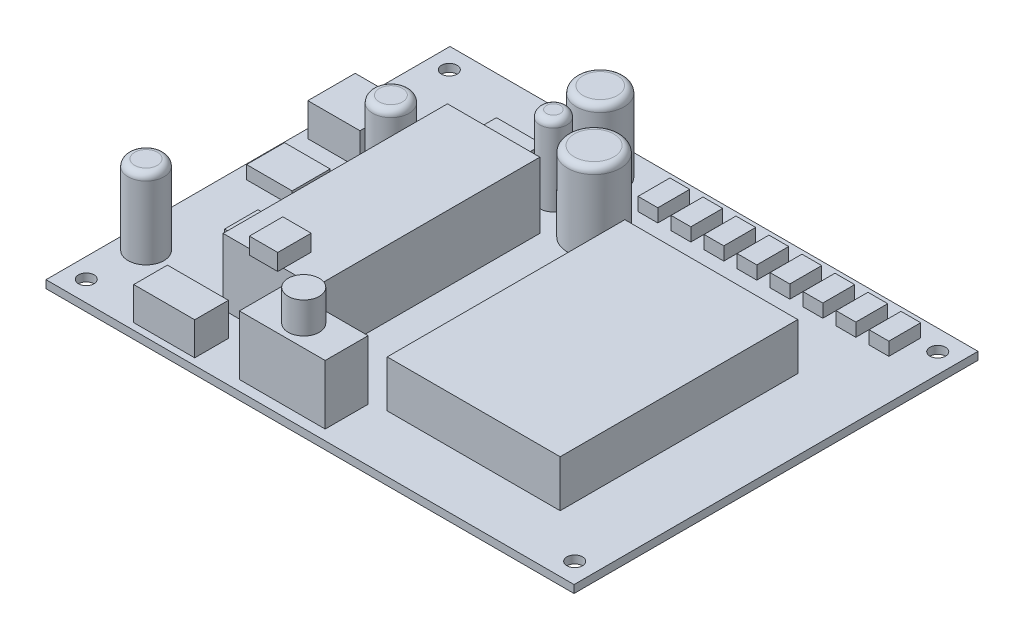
SolidWorks part; units mm, degrees
ref_plane "Front Plane" through (0, 0, 0) normal (0, 0, 1) x (1, 0, 0)
ref_plane "Top Plane" through (0, 0, 0) normal (0, 1, 0) x (1, 0, 0)
ref_plane "Right Plane" through (0, 0, 0) normal (1, 0, 0) x (0, 0, -1)
sketch "Sketch1" plane through (0, 0, 0) normal (0, 1, 0) x (1, 0, 0)
  line L1 (-50.8, -38.862) -> (50.8, -38.862)
  line L2 (-50.8, -38.862) -> (-50.8, 38.862)
  line L3 (-50.8, 38.862) -> (50.8, 38.862)
  line L4 (50.8, -38.862) -> (50.8, 38.862)
  line L5 (0, 38.862) -> (0, -38.862) construction
  line L6 (-50.8, 0) -> (50.8, 0) construction
  line L7 (-46.99, -34.925) -> (46.99, -34.925) construction
  line L8 (-46.99, -34.925) -> (-46.99, 34.925) construction
  line L9 (-46.99, 34.925) -> (46.99, 34.925) construction
  line L10 (46.99, -34.925) -> (46.99, 34.925) construction
  line L11 (0, 34.925) -> (0, -34.925) construction
  line L12 (-46.99, 0) -> (46.99, 0) construction
  circle A0 centre (-46.99, 34.925) radius 1.5
  circle A1 centre (46.99, 34.925) radius 1.5
  circle A2 centre (46.99, -34.925) radius 1.5
  circle A3 centre (-46.99, -34.925) radius 1.5
  point P0 (0, 0)
  point P4 (0, 0)
  dimension "D5" = 3
  dimension "D1" = 101.6
  dimension "D2" = 77.724
  dimension "D3" = 69.85
  dimension "D4" = 93.98
extrude "Boss-Extrude1" add sketch "Sketch1" along normal blind 1.5
sketch "Sketch2" plane through (0, 1.5, 0) normal (0, 1, 0) x (1, 0, 0)
  line L1 (-28.7841, -26.8116) -> (-11.0041, -26.8116)
  line L2 (-28.7841, -26.8116) -> (-28.7841, 16.3684)
  line L3 (-28.7841, 16.3684) -> (-11.0041, 16.3684)
  line L4 (-11.0041, -26.8116) -> (-11.0041, 16.3684)
  line L5 (-19.8941, 16.3684) -> (-19.8941, -26.8116) construction
  line L6 (-28.7841, -5.2216) -> (-11.0041, -5.2216) construction
  point P0 (-19.8941, -5.2216)
  dimension "D1" = 17.78
  dimension "D2" = 43.18
extrude "Boss-Extrude2" add sketch "Sketch2" along normal blind 12.7
sketch "Sketch3" plane through (0, 1.5, 0) normal (0, 1, 0) x (1, 0, 0)
  line L1 (-15.5609, -36.8933) -> (0.9491, -36.8933)
  line L2 (-15.5609, -36.8933) -> (-15.5609, -28.6383)
  line L3 (-15.5609, -28.6383) -> (0.9491, -28.6383)
  line L4 (0.9491, -36.8933) -> (0.9491, -28.6383)
  line L5 (-7.3059, -28.6383) -> (-7.3059, -36.8933) construction
  line L6 (-15.5609, -32.7658) -> (0.9491, -32.7658) construction
  point P0 (-7.3059, -32.7658)
  dimension "D1" = 16.51
  dimension "D2" = 8.255
extrude "Boss-Extrude3" add sketch "Sketch3" along normal blind 11.43
sketch "Sketch4" plane through (0, 12.93, 0) normal (0, 1, 0) x (1, 0, 0)
  line L0 (0.9491, -36.8933) -> (0.9491, -28.6383) construction
  line L1 (0.9491, -28.6383) -> (-15.5609, -28.6383) construction
  circle A0 centre (-7.3059, -32.7658) radius 3
  point P2 (0.9491, -32.7658)
  point P3 (-7.3059, -28.6383)
  dimension "D1" = 6
extrude "Boss-Extrude4" add sketch "Sketch4" along normal blind 6
sketch "Sketch5" plane through (0, 1.5, 0) normal (0, 1, 0) x (1, 0, 0)
  line L1 (3.8917, -27.9009) -> (37.1657, -27.9009)
  line L2 (3.8917, -27.9009) -> (3.8917, 17.8191)
  line L3 (3.8917, 17.8191) -> (37.1657, 17.8191)
  line L4 (37.1657, -27.9009) -> (37.1657, 17.8191)
  line L5 (20.5287, 17.8191) -> (20.5287, -27.9009) construction
  line L6 (3.8917, -5.0409) -> (37.1657, -5.0409) construction
  point P0 (20.5287, -5.0409)
  dimension "D1" = 33.274
  dimension "D2" = 45.72
extrude "Boss-Extrude5" add sketch "Sketch5" along normal blind 9
sketch "Sketch6" plane through (0, 1.5, 0) normal (0, 1, 0) x (1, 0, 0)
  circle A0 centre (-14.5848, 31.5625) radius 4.5706
  circle A1 centre (-15.1058, 23.0764) radius 2.6054
  circle A2 centre (-5.2053, 20.992) radius 5.0799
  circle A3 centre (-33.1203, 9.8261) radius 3.5042
  circle A4 centre (-46.0728, -24.3418) radius 3.4532
extrude "Boss-Extrude6" add sketch "Sketch6" along normal blind 15.24
fillet "Fillet1" radius 1.27 5 edges at (-46.0728, 16.74, 27.7951) (-33.1203, 16.74, -6.3218) (-14.5848, 16.74, -26.9919) (-15.1058, 16.74, -20.471) (-5.2053, 16.74, -15.9121)
sketch "Sketch7" plane through (0, 1.5, 0) normal (0, 1, 0) x (1, 0, 0)
  line L0 (1.163, 35.5783) -> (4.9619, 35.5783)
  line L1 (-48.1439, 4.3834) -> (-39.3772, 4.3834)
  line L2 (-48.1439, 4.3834) -> (-48.1439, -2.9222)
  line L3 (-48.1439, -2.9222) -> (-39.3772, -2.9222)
  line L4 (-39.3772, 4.3834) -> (-39.3772, -2.9222)
  line L5 (-43.7606, -2.9222) -> (-43.7606, 4.3834) construction
  line L6 (-48.1439, 0.7306) -> (-39.3772, 0.7306) construction
  line L7 (-39.5233, -9.3512) -> (-32.3638, -9.3512)
  line L8 (-39.5233, -9.3512) -> (-39.5233, -15.7801)
  line L9 (-39.5233, -15.7801) -> (-32.3638, -15.7801)
  line L10 (-32.3638, -9.3512) -> (-32.3638, -15.7801)
  line L11 (-35.9436, -15.7801) -> (-35.9436, -9.3512) construction
  line L12 (-39.5233, -12.5656) -> (-32.3638, -12.5656) construction
  line L13 (-31.9255, 28.9302) -> (-23.0126, 28.9302)
  line L14 (-31.9255, 28.9302) -> (-31.9255, 24.5468)
  line L15 (-31.9255, 24.5468) -> (-23.0126, 24.5468)
  line L16 (-23.0126, 28.9302) -> (-23.0126, 24.5468)
  line L17 (-27.4691, 24.5468) -> (-27.4691, 28.9302) construction
  line L18 (-31.9255, 26.7385) -> (-23.0126, 26.7385) construction
  line L19 (-5.187, 35.5783) -> (-1.3881, 35.5783)
  line L20 (-5.187, 35.5783) -> (-5.187, 29.4416)
  line L21 (-5.187, 29.4416) -> (-1.3881, 29.4416)
  line L22 (-1.3881, 35.5783) -> (-1.3881, 29.4416)
  line L23 (-3.2875, 29.4416) -> (-3.2875, 35.5783) construction
  line L24 (-5.187, 32.5099) -> (-1.3881, 32.5099) construction
  line L25 (1.163, 35.5783) -> (1.163, 29.4416)
  line L26 (1.163, 29.4416) -> (4.9619, 29.4416)
  line L27 (4.9619, 35.5783) -> (4.9619, 29.4416)
  line L28 (3.0625, 29.4416) -> (3.0625, 35.5783) construction
  line L29 (1.163, 32.5099) -> (4.9619, 32.5099) construction
  line L30 (7.513, 35.5783) -> (11.3119, 35.5783)
  line L31 (7.513, 35.5783) -> (7.513, 29.4416)
  line L32 (7.513, 29.4416) -> (11.3119, 29.4416)
  line L33 (11.3119, 35.5783) -> (11.3119, 29.4416)
  line L34 (9.4125, 29.4416) -> (9.4125, 35.5783) construction
  line L35 (7.513, 32.5099) -> (11.3119, 32.5099) construction
  line L36 (13.863, 35.5783) -> (17.6619, 35.5783)
  line L37 (13.863, 35.5783) -> (13.863, 29.4416)
  line L38 (13.863, 29.4416) -> (17.6619, 29.4416)
  line L39 (17.6619, 35.5783) -> (17.6619, 29.4416)
  line L40 (15.7625, 29.4416) -> (15.7625, 35.5783) construction
  line L41 (13.863, 32.5099) -> (17.6619, 32.5099) construction
  line L42 (20.213, 35.5783) -> (24.0119, 35.5783)
  line L43 (20.213, 35.5783) -> (20.213, 29.4416)
  line L44 (20.213, 29.4416) -> (24.0119, 29.4416)
  line L45 (24.0119, 35.5783) -> (24.0119, 29.4416)
  line L46 (22.1125, 29.4416) -> (22.1125, 35.5783) construction
  line L47 (20.213, 32.5099) -> (24.0119, 32.5099) construction
  line L48 (26.563, 35.5783) -> (30.3619, 35.5783)
  line L49 (26.563, 35.5783) -> (26.563, 29.4416)
  line L50 (26.563, 29.4416) -> (30.3619, 29.4416)
  line L51 (30.3619, 35.5783) -> (30.3619, 29.4416)
  line L52 (28.4625, 29.4416) -> (28.4625, 35.5783) construction
  line L53 (26.563, 32.5099) -> (30.3619, 32.5099) construction
  line L54 (32.913, 35.5783) -> (36.7119, 35.5783)
  line L55 (32.913, 35.5783) -> (32.913, 29.4416)
  line L56 (32.913, 29.4416) -> (36.7119, 29.4416)
  line L57 (36.7119, 35.5783) -> (36.7119, 29.4416)
  line L58 (34.8125, 29.4416) -> (34.8125, 35.5783) construction
  line L59 (32.913, 32.5099) -> (36.7119, 32.5099) construction
  line L60 (39.263, 35.5783) -> (43.0619, 35.5783)
  line L61 (39.263, 35.5783) -> (39.263, 29.4416)
  line L62 (39.263, 29.4416) -> (43.0619, 29.4416)
  line L63 (43.0619, 35.5783) -> (43.0619, 29.4416)
  line L64 (41.1625, 29.4416) -> (41.1625, 35.5783) construction
  line L65 (39.263, 32.5099) -> (43.0619, 32.5099) construction
  point P0 (-43.7606, 0.7306)
  point P4 (-35.9436, -12.5656)
  point P11 (-27.4691, 26.7385)
  point P18 (-3.2875, 32.5099)
  point P25 (3.0625, 32.5099)
  point P38 (9.4125, 32.5099)
  point P47 (15.7625, 32.5099)
  point P56 (22.1125, 32.5099)
  point P65 (28.4625, 32.5099)
  point P76 (34.8125, 32.5099)
  point P87 (41.1625, 32.5099)
  dimension "D1" = 8
extrude "Boss-Extrude7" add sketch "Sketch7" along normal blind 2.54
sketch "Sketch8" plane through (0, 1.5, 0) normal (0, 1, 0) x (1, 0, 0)
  line L1 (-49.0942, 9.8129) -> (-39.0593, 9.8129)
  line L2 (-49.0942, 9.8129) -> (-49.0942, 18.9216)
  line L3 (-49.0942, 18.9216) -> (-39.0593, 18.9216)
  line L4 (-39.0593, 9.8129) -> (-39.0593, 18.9216)
  line L5 (-44.0768, 18.9216) -> (-44.0768, 9.8129) construction
  line L6 (-49.0942, 14.3673) -> (-39.0593, 14.3673) construction
  line L7 (-35.1996, -37.5831) -> (-23.4664, -37.5831)
  line L8 (-35.1996, -37.5831) -> (-35.1996, -31.0989)
  line L9 (-35.1996, -31.0989) -> (-23.4664, -31.0989)
  line L10 (-23.4664, -37.5831) -> (-23.4664, -31.0989)
  line L11 (-29.333, -31.0989) -> (-29.333, -37.5831) construction
  line L12 (-35.1996, -34.341) -> (-23.4664, -34.341) construction
  point P0 (-44.0768, 14.3673)
  point P4 (-29.333, -34.341)
extrude "Boss-Extrude8" add sketch "Sketch8" along normal blind 6.35
sketch "Sketch9" plane through (0, 14.2, 0) normal (0, 1, 0) x (1, 0, 0)
  line L0 (-11.0041, 16.3684) -> (-28.7841, 16.3684) construction
  line L1 (-22.62, -27.9074) -> (-17.1682, -27.9074)
  line L2 (-22.62, -27.9074) -> (-22.62, -21.4785)
  line L3 (-22.62, -21.4785) -> (-17.1682, -21.4785)
  line L4 (-17.1682, -27.9074) -> (-17.1682, -21.4785)
  line L5 (-19.8941, -21.4785) -> (-19.8941, -27.9074) construction
  line L6 (-22.62, -24.6929) -> (-17.1682, -24.6929) construction
  point P0 (-19.8941, -24.6929)
  point P4 (-19.8941, 16.3684)
extrude "Boss-Extrude9" add sketch "Sketch9" along normal blind 3.175
